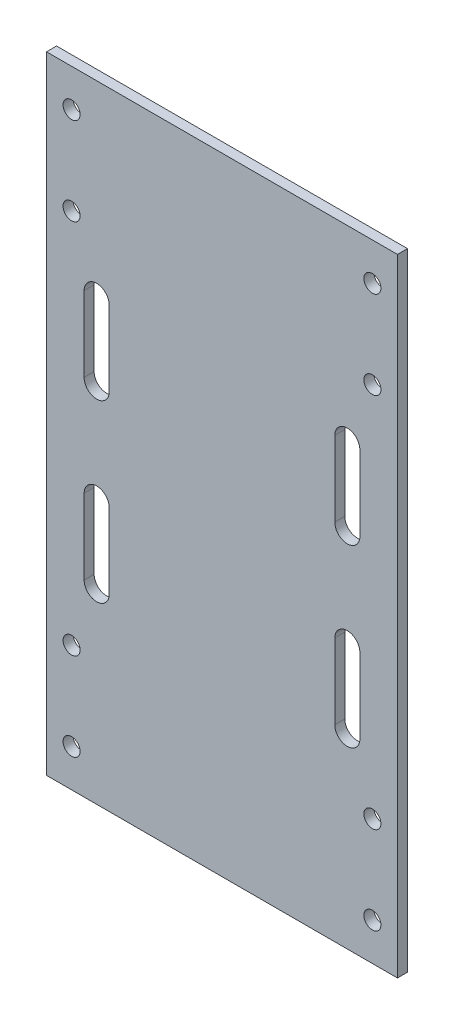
SolidWorks part; units mm, degrees
ref_plane "Front Plane" through (0, 0, 0) normal (0, 0, 1) x (1, 0, 0)
ref_plane "Top Plane" through (0, 0, 0) normal (0, 1, 0) x (1, 0, 0)
ref_plane "Right Plane" through (0, 0, 0) normal (1, 0, 0) x (0, 0, -1)
sketch "Sketch1" plane through (0, 0, 0) normal (0, 0, 1) x (1, 0, 0)
  line L1 (-35, -62.5) -> (35, -62.5)
  line L2 (-35, -62.5) -> (-35, 62.5)
  line L3 (-35, 62.5) -> (35, 62.5)
  line L4 (35, -62.5) -> (35, 62.5)
  line L5 (-35, -62.5) -> (35, 62.5) construction
  line L6 (-35, 62.5) -> (35, -62.5) construction
  dimension "D1" = 35
  dimension "D2" = 35
  dimension "D3" = 62.5
  dimension "D4" = 62.5
extrude "Boss-Extrude1" add sketch "Sketch1" against normal blind 2
sketch "Sketch2" plane through (0, 0, 0) normal (0, 0, 1) x (1, 0, 0)
  circle A0 centre (-30, -55) radius 1.7
  circle A1 centre (-30, -37.5) radius 1.7
  circle A2 centre (-30, 37.5) radius 1.7
  circle A3 centre (-30, 55) radius 1.7
  circle A4 centre (30, -55) radius 1.7
  circle A5 centre (30, -37.5) radius 1.7
  circle A6 centre (30, 37.5) radius 1.7
  circle A7 centre (30, 55) radius 1.7
  dimension "D1" = 3.4
  dimension "D2" = 30
  dimension "D3" = 30
  dimension "D4" = 37.5
  dimension "D5" = 55
  dimension "D6" = 37.5
  dimension "D7" = 55
extrude "Lo_xuyen_M3_D3_4" cut sketch "Sketch2" along normal through all and the other way through all
sketch "Sketch3" plane through (0, 0, 0) normal (0, 0, 1) x (1, 0, 0)
  line L1 (-27.5, -25) -> (-22.5, -25)
  line L2 (-27.5, -25) -> (-27.5, -10)
  line L3 (-27.5, -10) -> (-22.5, -10)
  line L4 (-22.5, -25) -> (-22.5, -10)
  line L5 (-27.5, -25) -> (-22.5, -10) construction
  line L6 (-27.5, -10) -> (-22.5, -25) construction
  line L7 (-27.5, 10) -> (-22.5, 10)
  line L8 (-27.5, 10) -> (-27.5, 25)
  line L9 (-27.5, 25) -> (-22.5, 25)
  line L10 (-22.5, 10) -> (-22.5, 25)
  line L11 (-27.5, 10) -> (-22.5, 25) construction
  line L12 (-27.5, 25) -> (-22.5, 10) construction
  line L13 (22.5, -25) -> (27.5, -25)
  line L14 (22.5, -25) -> (22.5, -10)
  line L15 (22.5, -10) -> (27.5, -10)
  line L16 (27.5, -25) -> (27.5, -10)
  line L17 (22.5, -25) -> (27.5, -10) construction
  line L18 (22.5, -10) -> (27.5, -25) construction
  line L19 (22.5, 10) -> (27.5, 10)
  line L20 (22.5, 10) -> (22.5, 25)
  line L21 (22.5, 25) -> (27.5, 25)
  line L22 (27.5, 10) -> (27.5, 25)
  line L23 (22.5, 10) -> (27.5, 25) construction
  line L24 (22.5, 25) -> (27.5, 10) construction
  point P0 (-25, -17.5)
  point P5 (-25, 17.5)
  point P10 (25, -17.5)
  point P15 (25, 17.5)
  dimension "D1" = 22.5
  dimension "D2" = 25
  dimension "D3" = 22.5
  dimension "D4" = 10
  dimension "D5" = 17.5
  dimension "D6" = 10
extrude "Than_ranh" cut sketch "Sketch3" along normal through all and the other way through all
sketch "Sketch4" plane through (0, 0, 0) normal (0, 0, 1) x (1, 0, 0)
  line L0 (-27.5, -25) -> (-22.5, -25) construction
  line L1 (-22.5, -10) -> (-27.5, -10) construction
  line L2 (-27.5, 10) -> (-22.5, 10) construction
  line L3 (-22.5, 25) -> (-27.5, 25) construction
  line L4 (22.5, -25) -> (27.5, -25) construction
  line L5 (27.5, -10) -> (22.5, -10) construction
  line L6 (22.5, 10) -> (27.5, 10) construction
  line L7 (27.5, 25) -> (22.5, 25) construction
  circle A0 centre (-25, -25) radius 2.5
  circle A1 centre (-25, -10) radius 2.5
  circle A2 centre (-25, 10) radius 2.5
  circle A3 centre (-25, 25) radius 2.5
  circle A4 centre (25, -25) radius 2.5
  circle A5 centre (25, -10) radius 2.5
  circle A6 centre (25, 10) radius 2.5
  circle A7 centre (25, 25) radius 2.5
extrude "Dau_ranh_R2_5" cut sketch "Sketch4" along normal through all and the other way through all
